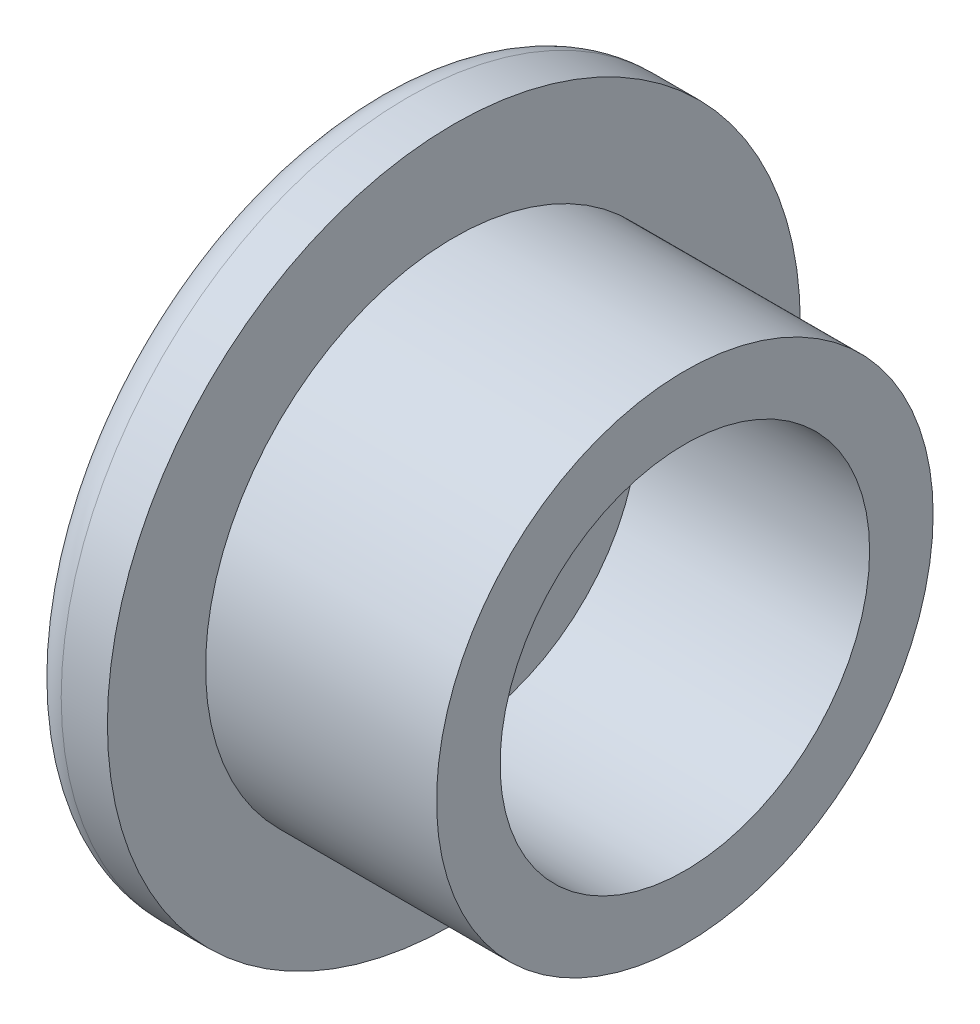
SolidWorks part; units mm, degrees
ref_plane "Front Plane" through (0, 0, 0) normal (0, 0, 1) x (1, 0, 0)
ref_plane "Top Plane" through (0, 0, 0) normal (0, 1, 0) x (1, 0, 0)
ref_plane "Right Plane" through (0, 0, 0) normal (1, 0, 0) x (0, 0, -1)
sketch "Sketch1" plane through (0, 0, 0) normal (1, 0, 0) x (0, 0, -1)
  circle A0 centre (0, 0) radius 8
  circle A1 centre (0, 0) radius 10.75
  dimension "D1" = 16
  dimension "D2" = 21.5
extrude "Boss-Extrude1" add sketch "Sketch1" along normal blind 10
sketch "Sketch2" plane through (0, 0, 0) normal (-1, 0, 0) x (0, 0, 1)
  circle A0 centre (0, 0) radius 15
  dimension "D1" = 30
extrude "Boss-Extrude2" add sketch "Sketch2" along normal blind 3.5
fillet "Fillet1" radius 1.5 1 edges at (-3.5, 0, 15)
